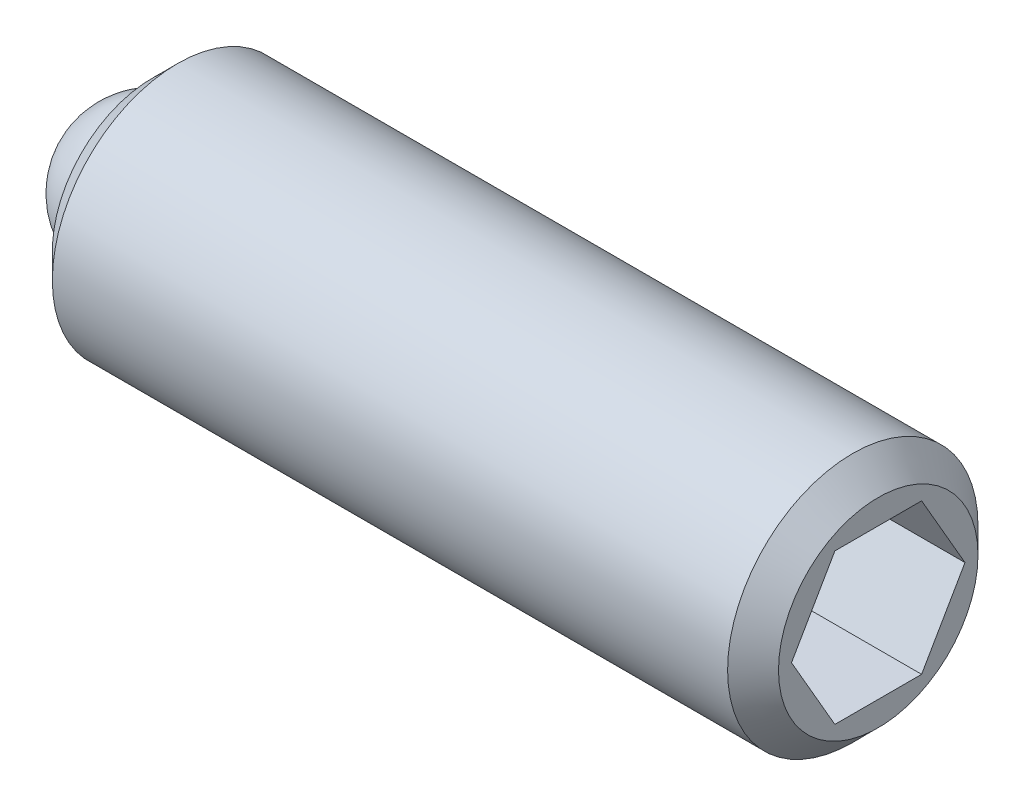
SolidWorks part; units mm, degrees
ref_plane "Front Plane" through (0, 0, 0) normal (0, 0, 1) x (1, 0, 0)
ref_plane "Top Plane" through (0, 0, 0) normal (0, 1, 0) x (1, 0, 0)
ref_plane "Right Plane" through (0, 0, 0) normal (1, 0, 0) x (0, 0, -1)
sketch "Sketch2" plane through (0, 0, 0) normal (1, 0, 0) x (0, 0, -1)
  circle A0 centre (0, 0) radius 1.25
  dimension "D1" = 2.5
extrude "Boss-Extrude1" add sketch "Sketch2" along normal blind 7.25
sketch "Sketch3" plane through (0, 0, 0) normal (-1, 0, 0) x (0, 0, 1)
  circle A0 centre (0, 0) radius 0.75
  dimension "D1" = 1.5
chamfer "Chamfer1" distance 0.254 angle 45 1 edges at (0, 0, -1.25)
chamfer "Chamfer2" distance 0.254 angle 45 1 edges at (7.25, 0, -1.25)
sketch "Sketch4" plane through (7.25, 0, 0) normal (1, 0, 0) x (0, 0, -1)
  line L1 (0.866, 0) -> (0.433, 0.75)
  line L2 (0.433, 0.75) -> (-0.433, 0.75)
  line L3 (-0.433, 0.75) -> (-0.866, 0)
  line L4 (-0.866, 0) -> (-0.433, -0.75)
  line L5 (-0.433, -0.75) -> (0.433, -0.75)
  line L6 (0.433, -0.75) -> (0.866, 0)
  circle A0 centre (0, 0) radius 0.75 construction
  dimension "D1" = 1.5
extrude "Cut-Extrude2" cut sketch "Sketch4" against normal blind 2
extrude "Cut-Extrude3" cut sketch "Sketch3" against normal blind 0.8
sketch "Sketch5" plane through (0, 0, 0) normal (-1, 0, 0) x (0, 0, 1)
  line L0 (0, 0) -> (0, -0.75)
  line L1 (0, 0) -> (0, 0.75)
  arc A0 (0, 0.75) -> (0, -0.75) centre (0, 0) ccw
  dimension "D1" = 0.75
revolve "Revolve1" add sketch "Sketch5" angle 360 about L1
